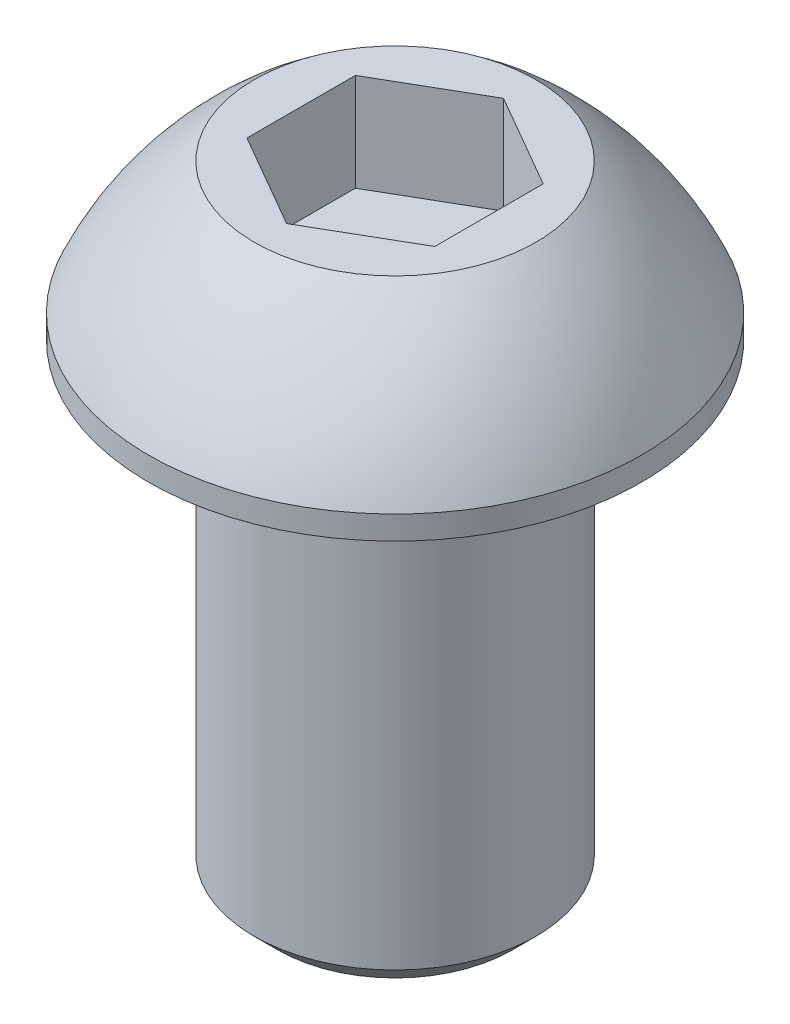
SolidWorks part; units mm, degrees
ref_plane "Face" through (0, 0, 0) normal (0, 0, 1) x (1, 0, 0)
ref_plane "Dessus" through (0, 0, 0) normal (0, 1, 0) x (1, 0, 0)
ref_plane "Droite" through (0, 0, 0) normal (1, 0, 0) x (0, 0, -1)
sketch "Esquisse1" plane through (0, 0, 0) normal (0, 0, 1) x (1, 0, 0)
  line L0 (0, 3.3) -> (0, -10) construction
  line L1 (0, -10) -> (2.5, -10)
  line L2 (3, -9.5) -> (3, -0.25)
  line L3 (3.25, 0) -> (5.25, 0)
  line L4 (5.25, 0) -> (5.25, 0.5)
  line L5 (0, 3.3) -> (3, 3.3)
  line L6 (2.5, -10) -> (3, -9.5)
  line L7 (0, 3.3) -> (0, -10)
  arc A0 (3, 3.3) -> (5.25, 0.5) centre (-1.0198, -2.2342) cw
  arc A1 (3.25, 0) -> (3, -0.25) centre (3.25, -0.25) ccw
  dimension "D6" = 6.84
  dimension "D9" = 0.25
  dimension "D1" = 3.3
  dimension "D2" = 6
  dimension "D3" = 45
  dimension "D4" = 0.5
  dimension "D5" = 10.5
  dimension "D7" = 0.5
  dimension "D8" = 10
revolve "Révolution1" add sketch "Esquisse1" angle 360 about L0
sketch "Esquisse2" plane through (0, 3.3, 0) normal (0, 1, 0) x (-1, 0, 0)
  line L1 (0, -2.3094) -> (2, -1.1547)
  line L2 (2, -1.1547) -> (2, 1.1547)
  line L3 (2, 1.1547) -> (0, 2.3094)
  line L4 (0, 2.3094) -> (-2, 1.1547)
  line L5 (-2, 1.1547) -> (-2, -1.1547)
  line L6 (-2, -1.1547) -> (0, -2.3094)
  circle A0 centre (0, 0) radius 2 construction
  dimension "D1" = 4
extrude "Enlèv. mat.-Extru.1" cut sketch "Esquisse2" against normal blind 2.08
equation "\"D6@Esquisse1\" = \"D2@Esquisse1\"*1.14"
equation "\"D4@Esquisse1\" = (\"D2@Esquisse1\"-\"D2@Représentation de filetage1\")/2"
equation "\"D7@Esquisse1\" = (\"D2@Esquisse1\"-\"D2@Représentation de filetage1\")/2"
equation "\"D1@Enlèv. mat.-Extru.1\" = \"D1@Esquisse2\"*0.52"
equation "\"D9@Esquisse1\" = (\"D2@Esquisse1\"-\"D2@Représentation de filetage1\")/4"
